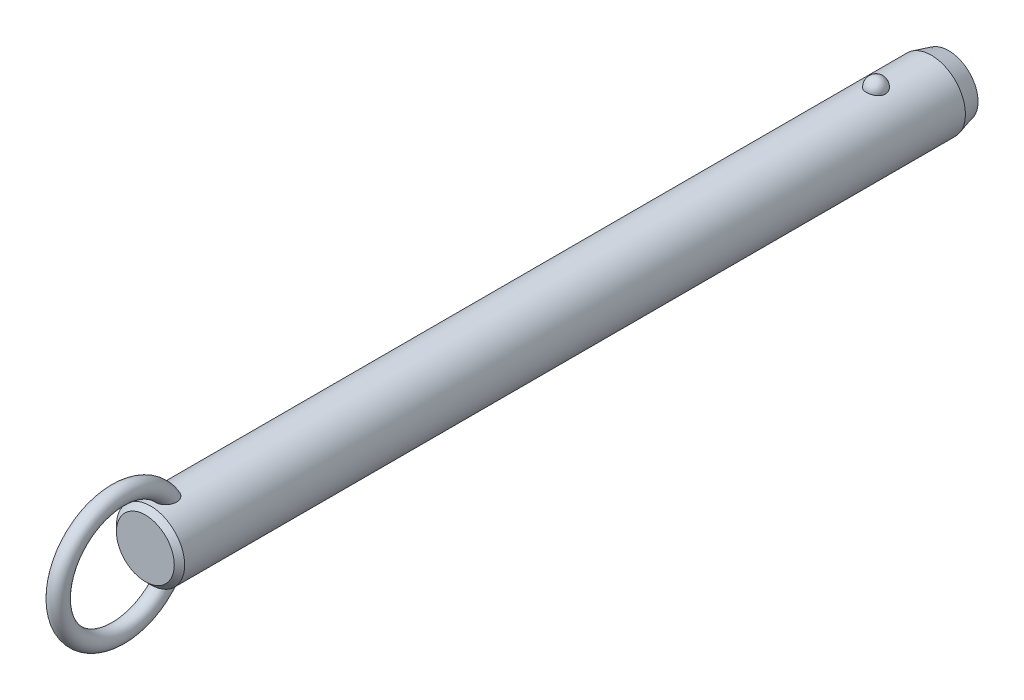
SolidWorks part; units mm, degrees
ref_plane "Front Plane" through (0, 0, 0) normal (0, 0, 1) x (1, 0, 0)
ref_plane "Top Plane" through (0, 0, 0) normal (0, 1, 0) x (1, 0, 0)
ref_plane "Right Plane" through (0, 0, 0) normal (1, 0, 0) x (0, 0, -1)
sketch "Sketch2" plane through (0, 0, 0) normal (0, 0, 1) x (1, 0, 0)
  circle A0 centre (0, 0) radius 7.9
  point P3 (0, 7.9)
  dimension "D1" = 15.8
extrude "Boss-Extrude1" add sketch "Sketch2" along normal blind 157.5
sketch "Sketch3" plane through (0, 0, 0) normal (0, 0, -1) x (-1, 0, 0)
  circle A0 centre (0, 0) radius 7.9
  dimension "D1" = 15.8
extrude "Boss-Extrude2" add sketch "Sketch3" along normal blind 19
chamfer "Chamfer1" distance 4 angle 15 1 edges at (-7.9, 0, -19)
sketch "Sketch12" plane through (0, 0, 0) normal (1, 0, 0) x (0, 0, -1)
  line L0 (-157.5, 7.9) -> (-157.5, -7.9) construction
  point P0 (-157.5, 0)
sketch "Sketch13" plane through (0, 0, 0) normal (1, 0, 0) x (0, 0, -1)
  circle A0 centre (-173.35, 0) radius 15.85
  point P2 (-157.5, 0)
  dimension "D1" = 31.7
sketch "Sketch14" plane through (0, 0, 0) normal (0, 1, 0) x (1, 0, 0)
  circle A0 centre (0, -159.5) radius 2
  point P2 (0, -157.5)
  dimension "D1" = 4
sweep "Sweep1" add profiles "Sketch14" path "Sketch13"
sketch "Sketch15" plane through (0, 0, 157.5) normal (0, 0, 1) x (1, 0, 0)
  circle A0 centre (0, 0) radius 7.9
  dimension "D1" = 15.8
extrude "Boss-Extrude3" add sketch "Sketch15" along normal blind 9.52
chamfer "Chamfer2" distance 1.2 angle 45 1 edges at (7.9, 0, 167.02)
sketch "Sketch18" plane through (0, 0, 0) normal (1, 0, 0) x (0, 0, -1)
  line L0 (15, 7.9) -> (-159.6091, 7.9) construction
  line L1 (2.2, 10.1) -> (2.2, 5.7)
  line L2 (-159.6091, -7.9) -> (15, -7.9) construction
  arc A0 (2.2, 10.1) -> (2.2, 5.7) centre (2.2, 7.9) ccw
  point P4 (0, 7.9)
  dimension "D1" = 18
revolve "Revolve1" add sketch "Sketch18" angle 360 about L1
